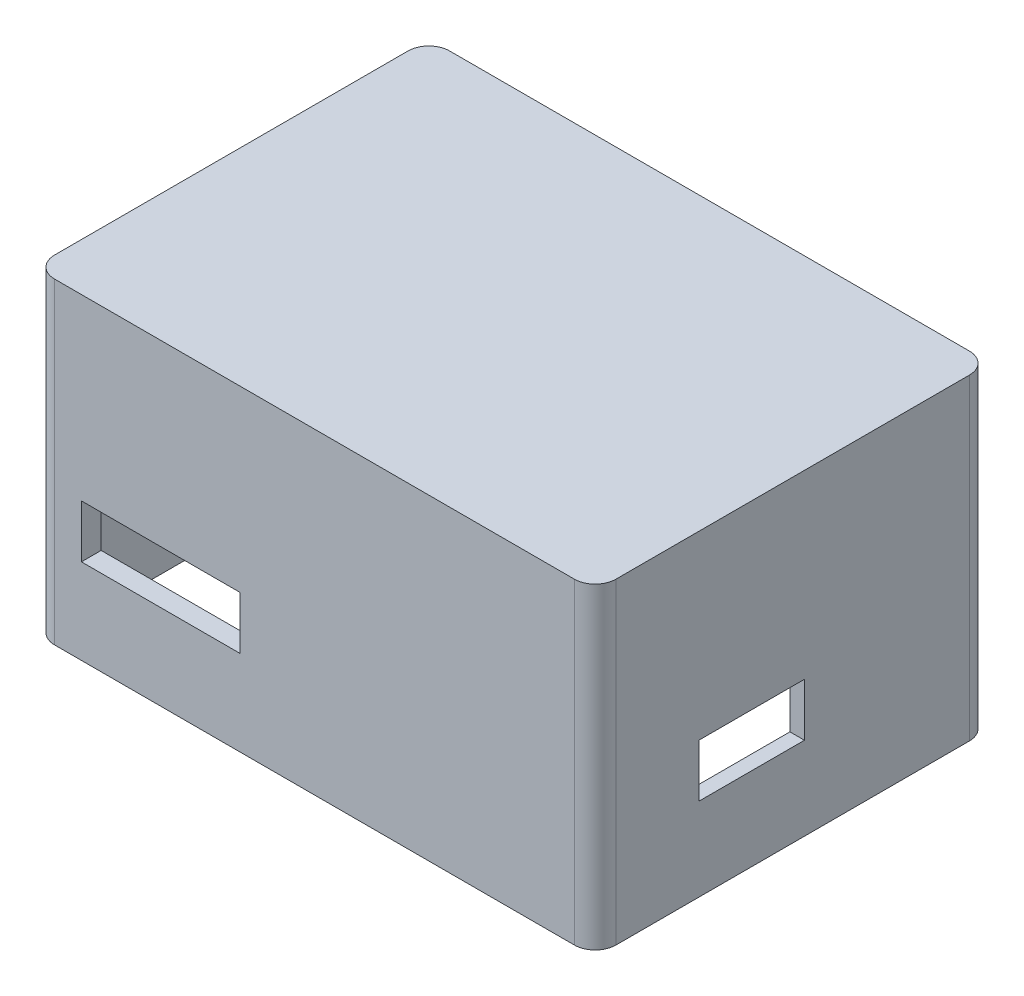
SolidWorks part; units mm, degrees
other "Markup1"
sketch "Sketch5" plane through (127, 25.4, -88.9) normal (0.0483, 0.9975, -0.051) x (0.9985, -0.0497, -0.025)
ref_plane "Front Plane" through (0, 0, 0) normal (0, 0, 1) x (1, 0, 0)
ref_plane "Top Plane" through (0, 0, 0) normal (0, 1, 0) x (1, 0, 0)
ref_plane "Right Plane" through (0, 0, 0) normal (1, 0, 0) x (0, 0, -1)
sketch "Sketch1" plane through (0, 0, 0) normal (0, 1, 0) x (1, 0, 0)
  line L1 (0, 0) -> (135, 0)
  line L2 (0, 0) -> (0, 95)
  line L3 (0, 95) -> (135, 95)
  line L4 (135, 0) -> (135, 95)
  dimension "D1" = 135
  dimension "D2" = 95
extrude "Boss-Extrude1" add sketch "Sketch1" along normal blind 76.2
sketch "Sketch4" plane through (0, 0, 0) normal (0, -1, 0) x (1, 0, 0)
  line L1 (131.5, -90.1467) -> (3.0638, -90.1467)
  line L2 (131.5, -90.1467) -> (131.5, -4.7467)
  line L3 (131.5, -4.7467) -> (3.0638, -4.7467)
  line L4 (3.0638, -90.1467) -> (3.0638, -4.7467)
  line L5 (135, -95) -> (0, -95) construction
  dimension "D1" = 128.4362
  dimension "D2" = 85.4
  dimension "D3" = 4.8533
extrude "Cut-Extrude2" cut sketch "Sketch4" against normal blind 63.5
fillet "Fillet1" radius 5 4 edges at (135, 38.1, -95) (135, 38.1, 0) (0, 38.1, 0) (0, 38.1, -95)
sketch "Sketch6" plane through (0, 0, -4.7467) normal (0, 0, -1) x (-1, 0, 0)
  line L1 (-49.5569, 33.2344) -> (-11.4569, 33.2344)
  line L2 (-49.5569, 33.2344) -> (-49.5569, 20.5344)
  line L3 (-49.5569, 20.5344) -> (-11.4569, 20.5344)
  line L4 (-11.4569, 33.2344) -> (-11.4569, 20.5344)
  point P4 (-11.4569, 20.5344)
  dimension "D1" = 38.1
  dimension "D2" = 12.7
extrude "Cut-Extrude3" cut sketch "Sketch6" against normal through all
sketch "Sketch7" plane through (131.5, 0, 0) normal (-1, 0, 0) x (0, 0, 1)
  line L1 (-50.3285, 19.9863) -> (-24.9285, 19.9863)
  line L2 (-50.3285, 19.9863) -> (-50.3285, 32.6863)
  line L3 (-50.3285, 32.6863) -> (-24.9285, 32.6863)
  line L4 (-24.9285, 19.9863) -> (-24.9285, 32.6863)
  dimension "D1" = 25.4
  dimension "D2" = 12.7
extrude "Cut-Extrude4" cut sketch "Sketch7" against normal through all
sketch "Sketch8" plane through (0, 0, -95) normal (0, 0, -1) x (-1, 0, 0)
  line L1 (-90.8971, 59.0133) -> (-46.4471, 59.0133)
  line L2 (-90.8971, 59.0133) -> (-90.8971, 39.9633)
  line L3 (-90.8971, 39.9633) -> (-46.4471, 39.9633)
  line L4 (-46.4471, 59.0133) -> (-46.4471, 39.9633)
  dimension "D1" = 44.45
  dimension "D2" = 19.05
extrude "Cut-Extrude5" cut sketch "Sketch8" against normal blind 10
fillet "Fillet2" radius 6.35 4 edges at (90.8971, 39.9633, -92.5733) (90.8971, 59.0133, -92.5733) (46.4471, 39.9633, -92.5733) (46.4471, 59.0133, -92.5733)
